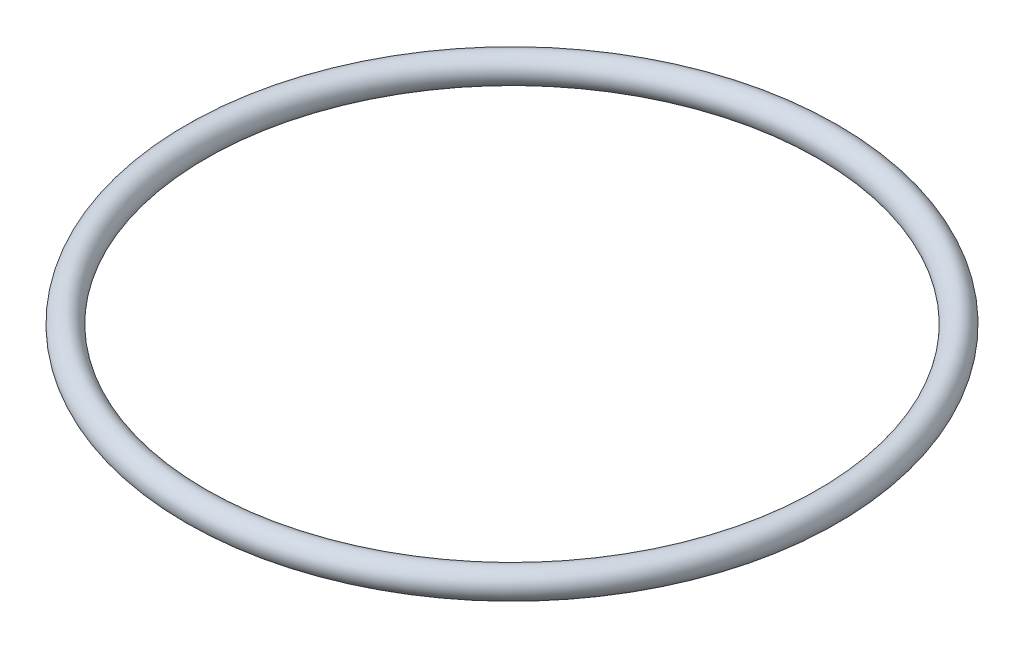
SolidWorks part; units mm, degrees
ref_plane "Face" through (0, 0, 0) normal (0, 0, 1) x (1, 0, 0)
ref_plane "Dessus" through (0, 0, 0) normal (0, 1, 0) x (1, 0, 0)
ref_plane "Droite" through (0, 0, 0) normal (1, 0, 0) x (0, 0, -1)
sketch "Esquisse1" plane through (0, 0, 0) normal (0, 0, 1) x (1, 0, 0)
  line L0 (0, 0) -> (34.5, 0) construction
  line L1 (0, 18.8529) -> (0, -18.8529) construction
  circle A0 centre (34.5, 0) radius 1.5
  dimension "D1" = 36
  dimension "D2" = 3
revolve "Base-Révolution" add sketch "Esquisse1" angle 360 about L1
